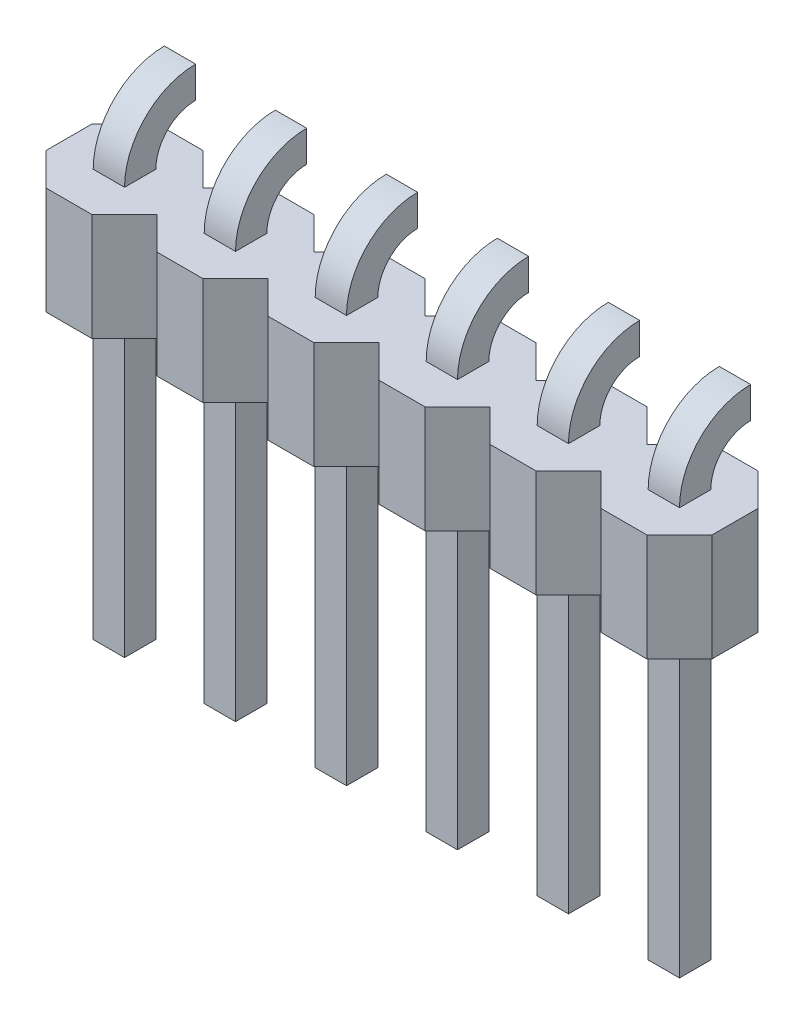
SolidWorks part; units mm, degrees
ref_plane "Front Plane" through (0, 0, 0) normal (0, 0, 1) x (1, 0, 0)
ref_plane "Top Plane" through (0, 0, 0) normal (0, 1, 0) x (1, 0, 0)
ref_plane "Right Plane" through (0, 0, 0) normal (1, 0, 0) x (0, 0, -1)
sketch "Sketch1" plane through (0, 0, 0) normal (0, 1, 0) x (1, 0, 0)
  line L0 (2.83, -0.35) -> (2.83, 0.35)
  line L1 (-0.35, -0.35) -> (0.35, -0.35)
  line L2 (-0.35, -0.35) -> (-0.35, 0.35)
  line L3 (-0.35, 0.35) -> (0.35, 0.35)
  line L4 (0.35, -0.35) -> (0.35, 0.35)
  line L5 (-0.35, -0.35) -> (0.35, 0.35) construction
  line L6 (-0.35, 0.35) -> (0.35, -0.35) construction
  line L7 (2.13, 0.35) -> (2.83, 0.35)
  line L8 (2.13, -0.35) -> (2.13, 0.35)
  line L9 (2.13, -0.35) -> (2.83, -0.35)
  line L10 (5.31, -0.35) -> (5.31, 0.35)
  line L11 (4.61, 0.35) -> (5.31, 0.35)
  line L12 (4.61, -0.35) -> (4.61, 0.35)
  line L13 (4.61, -0.35) -> (5.31, -0.35)
  line L14 (7.79, -0.35) -> (7.79, 0.35)
  line L15 (7.09, 0.35) -> (7.79, 0.35)
  line L16 (7.09, -0.35) -> (7.09, 0.35)
  line L17 (7.09, -0.35) -> (7.79, -0.35)
  line L18 (10.27, -0.35) -> (10.27, 0.35)
  line L19 (9.57, 0.35) -> (10.27, 0.35)
  line L20 (9.57, -0.35) -> (9.57, 0.35)
  line L21 (9.57, -0.35) -> (10.27, -0.35)
  line L22 (12.75, -0.35) -> (12.75, 0.35)
  line L23 (12.05, 0.35) -> (12.75, 0.35)
  line L24 (12.05, -0.35) -> (12.05, 0.35)
  line L25 (12.05, -0.35) -> (12.75, -0.35)
  point P0 (0, 0)
  dimension "D1" = 0.7
  dimension "D2" = 0.7
  dimension "D4" = 1.78
  dimension "D3" = 6
extrude "Boss-Extrude1" add sketch "Sketch1" along normal blind 9.1
sketch "Sketch3" plane through (0, 9.1, 0) normal (0, 1, 0) x (1, 0, 0)
  line L0 (-0.5136, 1.24) -> (-1.24, 0.5136)
  line L1 (-0.35, -0.35) -> (0.35, -0.35)
  line L2 (-0.35, -0.35) -> (-0.35, 0.35)
  line L3 (-0.35, 0.35) -> (0.35, 0.35)
  line L4 (0.35, -0.35) -> (0.35, 0.35)
  line L5 (-0.35, -0.35) -> (0.35, 0.35) construction
  line L6 (-0.35, 0.35) -> (0.35, -0.35) construction
  line L7 (-1.24, -0.5136) -> (-0.5136, -1.24)
  line L8 (-0.5136, -1.24) -> (0.5136, -1.24)
  line L9 (0.5136, -1.24) -> (1.24, -0.5136)
  line L10 (1.24, -0.5136) -> (1.24, 0.5136)
  line L11 (1.24, 0.5136) -> (0.5136, 1.24)
  line L12 (0.5136, 1.24) -> (-0.5136, 1.24)
  line L13 (-1.24, 0.5136) -> (-1.24, -0.5136)
  line L14 (2.83, 0.35) -> (2.13, -0.35) construction
  line L15 (2.83, -0.35) -> (2.13, 0.35) construction
  line L16 (3.72, -0.5136) -> (3.72, 0.5136)
  line L17 (2.9936, -1.24) -> (3.72, -0.5136)
  line L18 (2.83, 0.35) -> (2.13, 0.35)
  line L19 (2.13, 0.35) -> (2.13, -0.35)
  line L20 (2.13, -0.35) -> (2.83, -0.35)
  line L21 (2.83, -0.35) -> (2.83, 0.35)
  line L22 (2.83, 0.35) -> (2.13, 0.35) construction
  line L23 (2.13, 0.35) -> (2.13, -0.35) construction
  line L24 (2.13, -0.35) -> (2.83, -0.35) construction
  line L25 (2.83, -0.35) -> (2.83, 0.35) construction
  line L26 (1.9664, -1.24) -> (2.9936, -1.24)
  line L27 (1.24, -0.5136) -> (1.9664, -1.24)
  line L28 (1.24, 0.5136) -> (1.24, -0.5136)
  line L29 (1.9664, 1.24) -> (1.24, 0.5136)
  line L30 (2.9936, 1.24) -> (1.9664, 1.24)
  line L31 (3.72, 0.5136) -> (2.9936, 1.24)
  line L32 (6.2, -0.5136) -> (6.2, 0.5136)
  line L33 (5.4736, -1.24) -> (6.2, -0.5136)
  line L34 (4.4464, -1.24) -> (5.4736, -1.24)
  line L35 (3.72, -0.5136) -> (4.4464, -1.24)
  line L36 (3.72, 0.5136) -> (3.72, -0.5136)
  line L37 (4.4464, 1.24) -> (3.72, 0.5136)
  line L38 (5.4736, 1.24) -> (4.4464, 1.24)
  line L39 (6.2, 0.5136) -> (5.4736, 1.24)
  line L40 (8.68, -0.5136) -> (8.68, 0.5136)
  line L41 (7.9536, -1.24) -> (8.68, -0.5136)
  line L42 (6.9264, -1.24) -> (7.9536, -1.24)
  line L43 (6.2, -0.5136) -> (6.9264, -1.24)
  line L44 (6.2, 0.5136) -> (6.2, -0.5136)
  line L45 (6.9264, 1.24) -> (6.2, 0.5136)
  line L46 (7.9536, 1.24) -> (6.9264, 1.24)
  line L47 (8.68, 0.5136) -> (7.9536, 1.24)
  line L48 (11.16, -0.5136) -> (11.16, 0.5136)
  line L49 (10.4336, -1.24) -> (11.16, -0.5136)
  line L50 (9.4064, -1.24) -> (10.4336, -1.24)
  line L51 (8.68, -0.5136) -> (9.4064, -1.24)
  line L52 (8.68, 0.5136) -> (8.68, -0.5136)
  line L53 (9.4064, 1.24) -> (8.68, 0.5136)
  line L54 (10.4336, 1.24) -> (9.4064, 1.24)
  line L55 (11.16, 0.5136) -> (10.4336, 1.24)
  line L56 (13.64, -0.5136) -> (13.64, 0.5136)
  line L57 (12.9136, -1.24) -> (13.64, -0.5136)
  line L58 (11.8864, -1.24) -> (12.9136, -1.24)
  line L59 (11.16, -0.5136) -> (11.8864, -1.24)
  line L60 (11.16, 0.5136) -> (11.16, -0.5136)
  line L61 (11.8864, 1.24) -> (11.16, 0.5136)
  line L62 (12.9136, 1.24) -> (11.8864, 1.24)
  line L63 (13.64, 0.5136) -> (12.9136, 1.24)
  circle A0 centre (0, 0) radius 1.24 construction
  point P0 (0, 0)
  dimension "D1" = 0.7
  dimension "D2" = 0.7
  dimension "D4" = 1.24
  dimension "D3" = 0
  dimension "D5" = 6
extrude "Yükseklik-Ekstrüzyon1" add sketch "Sketch3" against normal blind 2.4 contours L56 L63 L62 L61 L48 L59 L58 L57 M16 M19 M18 M17 | L48 L55 L54 L53 L40 L51 L50 L49 | L40 L47 L46 L45 L32 L43 L42 L41 | L32 L39 L38 L37 L16 L35 L34 L33 | L16 L31 L30 L29 L10 L27 L26 L17 | L0 L13 L7 L8 L9 L10 L11 L12 L4 L1 L2 L3
sketch "Çizim1" plane through (0, 9.1, 0) normal (0, 1, 0) x (1, 0, 0)
  line L0 (10.27, 0.35) -> (9.57, 0.35)
  line L1 (10.27, -0.35) -> (10.27, 0.35)
  line L2 (9.57, -0.35) -> (10.27, -0.35)
  line L3 (9.57, 0.35) -> (9.57, -0.35)
  line L4 (12.75, 0.35) -> (12.05, 0.35)
  line L5 (12.75, -0.35) -> (12.75, 0.35)
  line L6 (12.05, -0.35) -> (12.75, -0.35)
  line L7 (12.05, 0.35) -> (12.05, -0.35)
  line L8 (12.75, 0.35) -> (12.05, 0.35)
  line L9 (12.75, -0.35) -> (12.75, 0.35)
  line L10 (12.05, -0.35) -> (12.75, -0.35)
  line L11 (12.05, 0.35) -> (12.05, -0.35)
  line L12 (7.79, 0.35) -> (7.09, 0.35)
  line L13 (7.79, -0.35) -> (7.79, 0.35)
  line L14 (7.09, -0.35) -> (7.79, -0.35)
  line L15 (7.09, 0.35) -> (7.09, -0.35)
  line L16 (5.31, 0.35) -> (4.61, 0.35)
  line L17 (5.31, -0.35) -> (5.31, 0.35)
  line L18 (4.61, -0.35) -> (5.31, -0.35)
  line L19 (4.61, 0.35) -> (4.61, -0.35)
  line L20 (2.83, 0.35) -> (2.13, 0.35)
  line L21 (2.83, -0.35) -> (2.83, 0.35)
  line L22 (2.13, -0.35) -> (2.83, -0.35)
  line L23 (2.13, 0.35) -> (2.13, -0.35)
  line L24 (0.35, 0.35) -> (-0.35, 0.35)
  line L25 (0.35, -0.35) -> (0.35, 0.35)
  line L26 (-0.35, -0.35) -> (0.35, -0.35)
  line L27 (-0.35, 0.35) -> (-0.35, -0.35)
  dimension "D1" = 0
  dimension "D2" = 6
revolve "Döndür1" add sketch "Çizim1" angle 90
